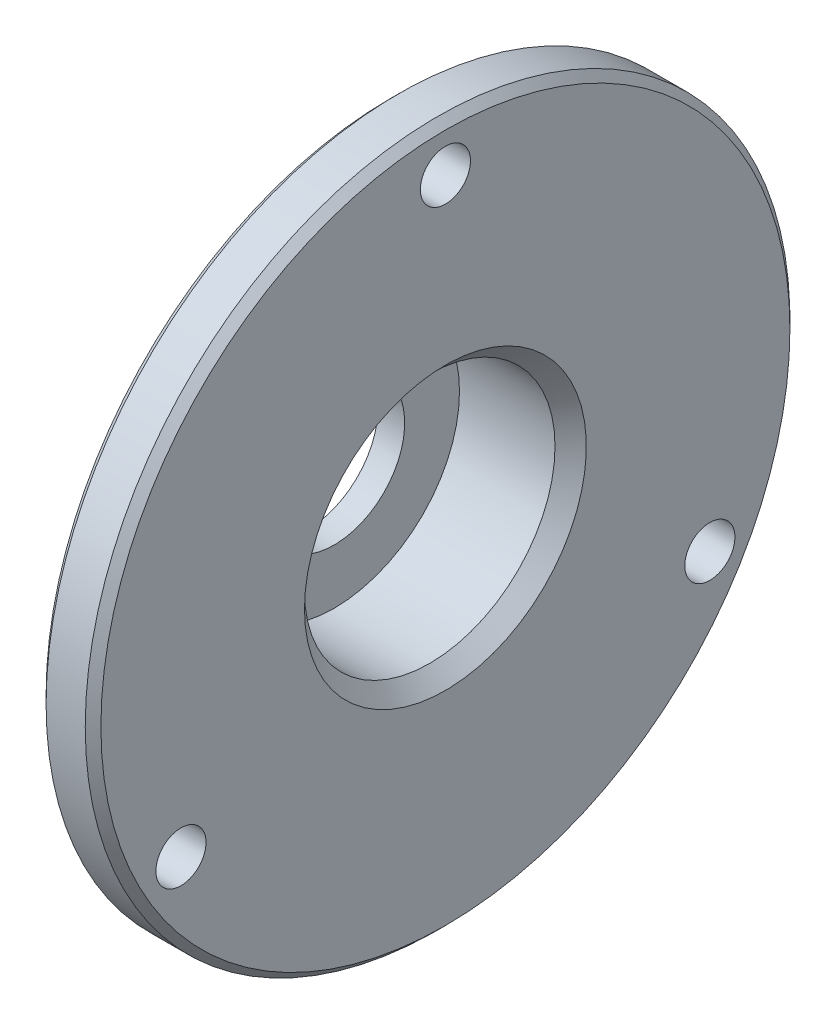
SolidWorks part; units mm, degrees
ref_plane "FACE" through (0, 0, 0) normal (0, 0, 1) x (1, 0, 0)
ref_plane "DESSUS" through (0, 0, 0) normal (0, 1, 0) x (1, 0, 0)
ref_plane "GAUCHE" through (0, 0, 0) normal (1, 0, 0) x (0, 0, -1)
sketch "Esquisse1" plane through (0, 0, 0) normal (0, 0, 1) x (1, 0, 0)
  line L0 (0, 0) -> (13, 0) construction
  line L1 (0, 4.5) -> (0, 12)
  line L2 (0, 12) -> (5.3, 12)
  line L3 (5.3, 12) -> (5.3, 22.5)
  line L4 (5.3, 22.5) -> (8.8, 22.5)
  line L5 (8.8, 22.5) -> (8.8, 8)
  line L6 (8.8, 8) -> (1.7, 8)
  line L7 (1.7, 8) -> (1.7, 4.5)
  line L8 (1.7, 4.5) -> (0, 4.5)
  dimension "D1" = 9
  dimension "D2" = 24
  dimension "D3" = 22.5
  dimension "D4" = 8.8
  dimension "D5" = 5.3
  dimension "D6" = 7.1
  dimension "D7" = 8
revolve "Base-Révolution" add sketch "Esquisse1" angle 360 about L0
sketch "Esquisse2" plane through (8.8, 0, 0) normal (1, 0, 0) x (0, 0, -1)
  line L0 (0, 50) -> (0, -50) construction
  circle A0 centre (0, 19.5) radius 1.6
  dimension "D1" = 3.2
  dimension "D2" = 19.5
extrude "Enlèv. mat.-Extru.1" cut sketch "Esquisse2" against normal through all
pattern_circular "Répétition circulaire1" count 3 every 120 about axis through (0, 0, 0) along (1, 0, 0)
chamfer "Chanfrein1" distance 1 angle 45
chamfer "Chanfrein2" distance 0.5 angle 45
